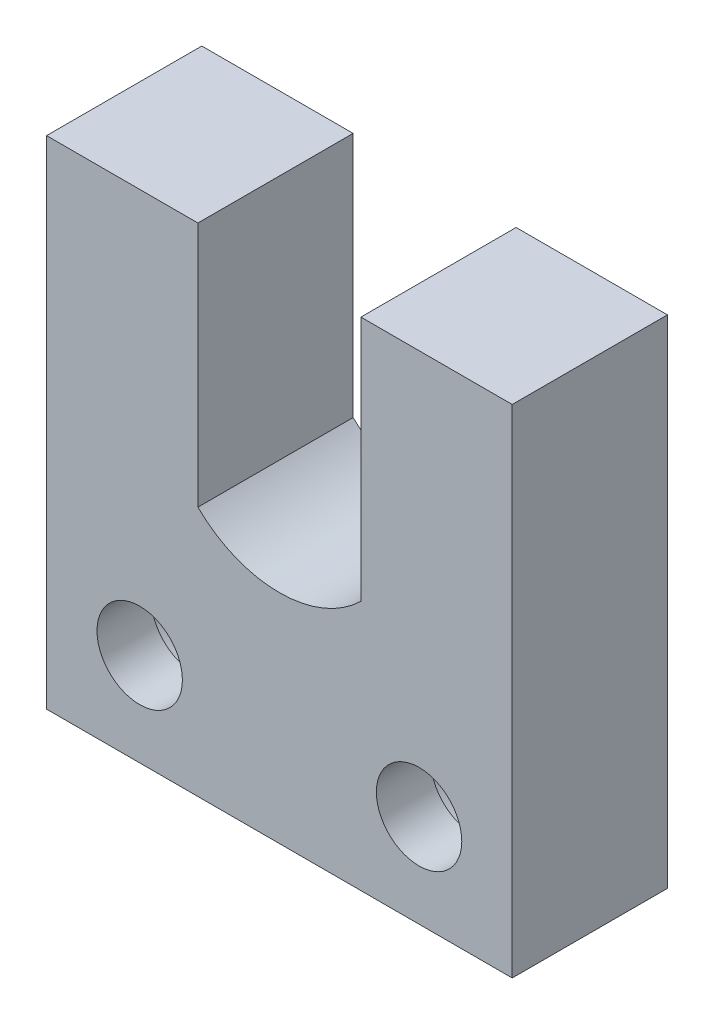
SolidWorks part; units mm, degrees
ref_plane "前视基准面" through (0, 0, 0) normal (0, 0, 1) x (1, 0, 0)
ref_plane "上视基准面" through (0, 0, 0) normal (0, 1, 0) x (1, 0, 0)
ref_plane "右视基准面" through (0, 0, 0) normal (1, 0, 0) x (0, 0, -1)
sketch "草图1" plane through (0, 0, 0) normal (0, 0, 1) x (1, 0, 0)
  line L0 (0, 0) -> (0, 32)
  line L1 (30, 0) -> (30, 32)
  line L2 (0, 0) -> (30, 0)
  line L3 (0, 32) -> (9.75, 32)
  line L4 (9.75, 16.1439) -> (9.75, 32)
  line L5 (20.25, 16.1439) -> (20.25, 32)
  line L6 (20.25, 32) -> (30, 32)
  circle A0 centre (24, 6) radius 2.75
  circle A1 centre (6, 6) radius 2.75
  arc A2 (9.75, 16.1439) -> (20.25, 16.1439) centre (15, 21.5) ccw
extrude "凸台-拉伸1" add sketch "草图1" along normal blind 10
sketch "草图2" plane through (0, 0, 10) normal (0, 0, 1) x (1, 0, 0)
  circle A0 centre (24, 6) radius 4.75 construction
  circle A1 centre (6, 6) radius 4.75 construction
sketch "草图3" plane through (0, 0, 0) normal (0, 0, -1) x (-1, 0, 0)
  circle A0 centre (-24, 6) radius 4.75
  circle A1 centre (-6, 6) radius 4.75
extrude "切除-拉伸1" cut sketch "草图3" against normal blind 6.5
